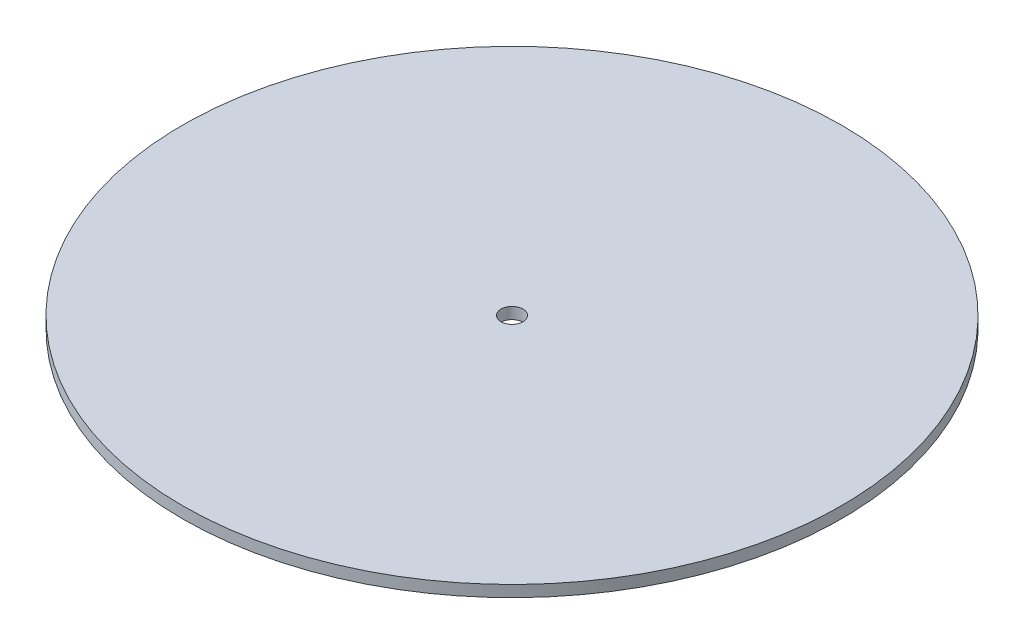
SolidWorks part; units mm, degrees
ref_plane "Front Plane" through (0, 0, 0) normal (0, 0, 1) x (1, 0, 0)
ref_plane "Top Plane" through (0, 0, 0) normal (0, 1, 0) x (1, 0, 0)
ref_plane "Right Plane" through (0, 0, 0) normal (1, 0, 0) x (0, 0, -1)
sketch "Sketch1" plane through (0, 0, 0) normal (0, 1, 0) x (1, 0, 0)
  circle A0 centre (0, 0) radius 95.25
  circle A1 centre (0, 0) radius 3.175
  dimension "D1" = 190.5
  dimension "D2" = 6.35
extrude "Boss-Extrude1" add sketch "Sketch1" along normal blind 3.302
